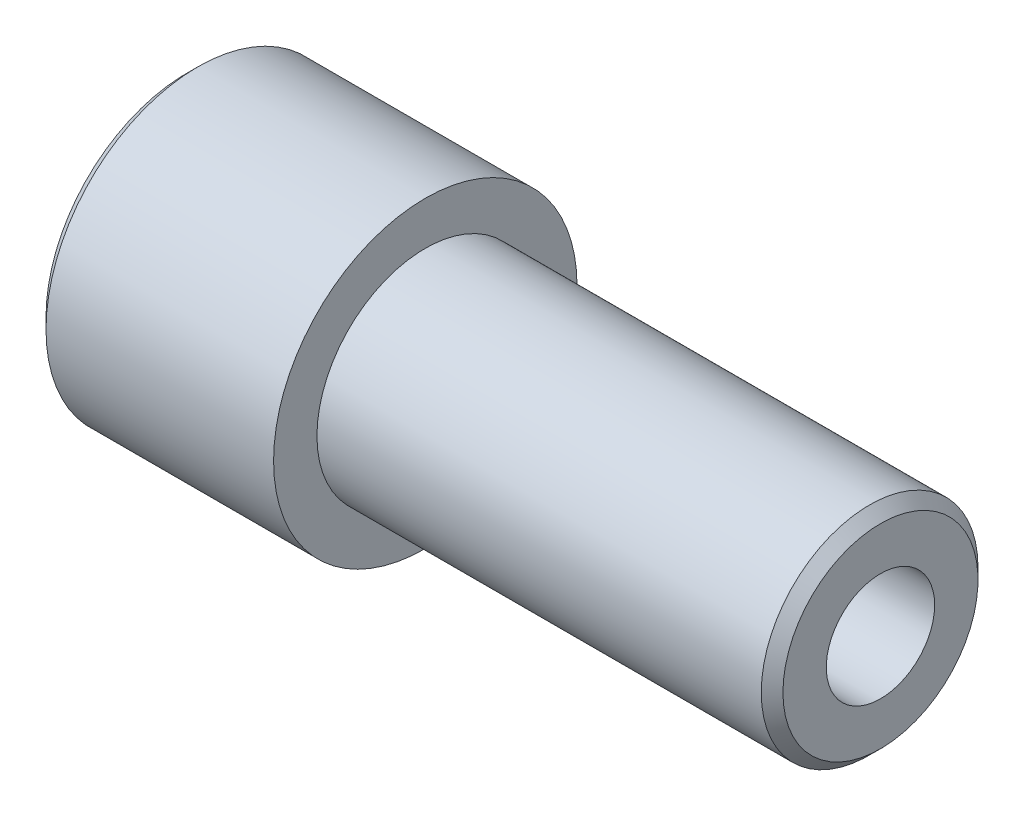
SolidWorks part; units mm, degrees
ref_plane "Plan de face" through (0, 0, 0) normal (0, 0, 1) x (1, 0, 0)
ref_plane "Plan de dessus" through (0, 0, 0) normal (0, 1, 0) x (1, 0, 0)
ref_plane "Plan de droite" through (0, 0, 0) normal (1, 0, 0) x (0, 0, -1)
sketch "Esquisse1" plane through (0, 0, 0) normal (0, 0, 1) x (1, 0, 0)
  line L0 (0, 0) -> (0, 7)
  line L1 (0, 7) -> (11, 7)
  line L2 (11, 7) -> (11, 5)
  line L3 (11, 5) -> (32, 5)
  line L4 (32, 5) -> (32, 0)
  line L5 (0, 0) -> (32, 0) construction
  line L6 (0, 0) -> (32, 0)
  dimension "D1" = 10
  dimension "D2" = 14
  dimension "D3" = 21
  dimension "D4" = 32
revolve "Révolution1" add sketch "Esquisse1" angle 360 about L5
hole_wizard "Trou taraudé M61" positions "Esquisse3" profile "Esquisse2" tap size "M6" standard "ISO"
sketch "Esquisse3" plane through (32, 0, 0) normal (1, 0, 0) x (0, 0, -1)
  point P0 (0, 0)
sketch "Esquisse2" plane through (32, 0, 0) normal (0, 1, 0) x (0, 0, -1)
  line L0 (0, 0) -> (0, 21.5022)
  line L1 (0, 21.5022) -> (2.5, 20)
  line L2 (2.5, 20) -> (2.5, 0)
  line L5 (2.5, 0) -> (0, 0)
  line L10 (0, 21.5022) -> (-2.5, 20) construction
  line L11 (0, -6.35) -> (0, 107.95) construction
  dimension "Diamètre du trou pour taraudage" = 5
  dimension "Profondeur du trou pour taraudage" = 20
  dimension "Angle de pointe" = 118
chamfer "Chanfrein1" distance 0.5 angle 45 2 edges at (32, 0, 5) (0, 0, 7)
